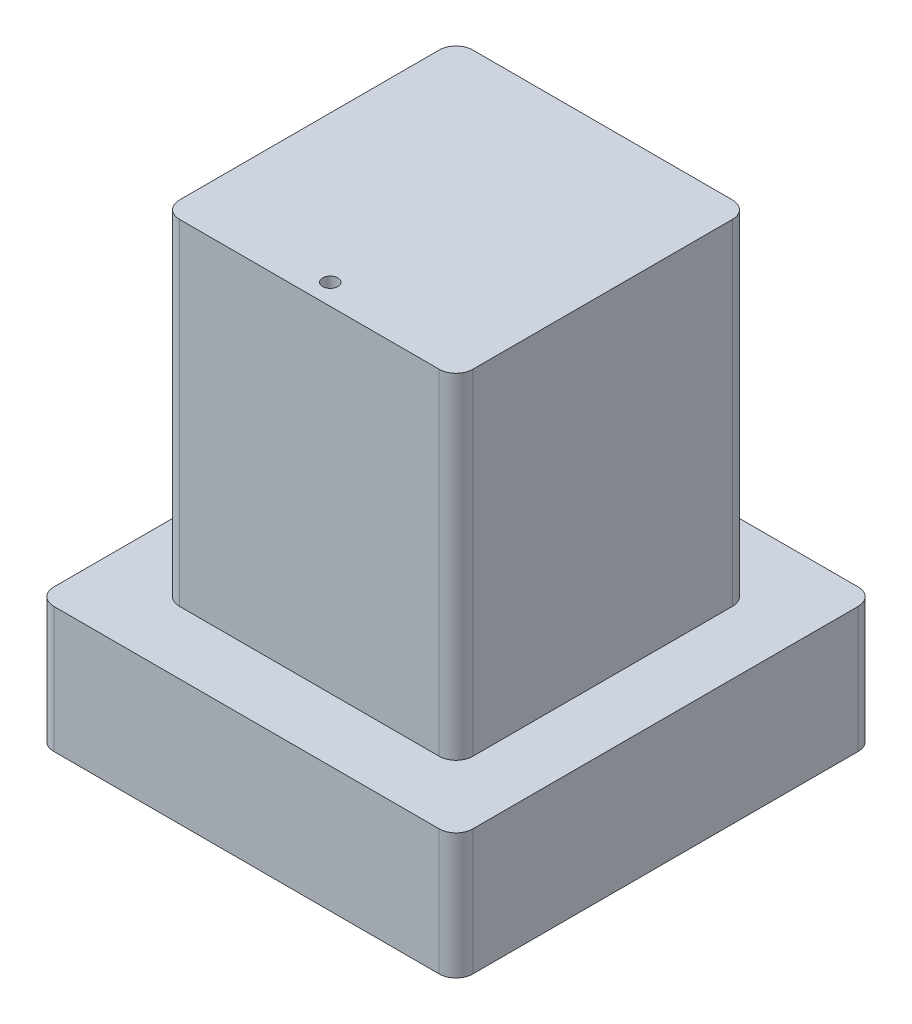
SolidWorks part; units mm, degrees
ref_plane "Front Plane" through (0, 0, 0) normal (0, 0, 1) x (1, 0, 0)
ref_plane "Top Plane" through (0, 0, 0) normal (0, 1, 0) x (1, 0, 0)
ref_plane "Right Plane" through (0, 0, 0) normal (1, 0, 0) x (0, 0, -1)
sketch "Sketch1" plane through (0, 0, 0) normal (0, 1, 0) x (1, 0, 0)
  line L1 (63.5, -63.5) -> (-63.5, -63.5)
  line L2 (63.5, -63.5) -> (63.5, 63.5)
  line L3 (63.5, 63.5) -> (-63.5, 63.5)
  line L4 (-63.5, -63.5) -> (-63.5, 63.5)
  line L5 (63.5, -63.5) -> (-63.5, 63.5) construction
  line L6 (63.5, 63.5) -> (-63.5, -63.5) construction
  point P0 (0, 0)
  dimension "D1" = 127
  dimension "D2" = 127
extrude "Boss-Extrude1" add sketch "Sketch1" along normal blind 38.1
sketch "Sketch2" plane through (0, 38.1, 0) normal (0, 1, 0) x (1, 0, 0)
  line L1 (44.45, 44.45) -> (-44.45, 44.45)
  line L2 (44.45, 44.45) -> (44.45, -44.45)
  line L3 (44.45, -44.45) -> (-44.45, -44.45)
  line L4 (-44.45, 44.45) -> (-44.45, -44.45)
  line L5 (44.45, 44.45) -> (-44.45, -44.45) construction
  line L6 (44.45, -44.45) -> (-44.45, 44.45) construction
  point P0 (0, 0)
  dimension "D1" = 88.9
  dimension "D2" = 88.9
extrude "Boss-Extrude2" add sketch "Sketch2" along normal blind 101.6 separate body
fillet "Fillet1" radius 5.08 4 edges at (63.5, 19.05, 63.5) (63.5, 19.05, -63.5) (-63.5, 19.05, -63.5) (-63.5, 19.05, 63.5)
fillet "Fillet2" radius 5.08 4 edges at (44.45, 88.9, 44.45) (-44.45, 88.9, 44.45) (-44.45, 88.9, -44.45) (44.45, 88.9, -44.45)
sketch "Sketch3" plane through (0, 139.7, 0) normal (0, 1, 0) x (1, 0, 0)
  line L0 (-39.37, -44.45) -> (39.37, -44.45) construction
  circle A0 centre (0, -38.1) radius 2.2987
  dimension "D1" = 4.5974
  dimension "D2" = 6.35
extrude "Cut-Extrude1" cut sketch "Sketch3" against normal blind 6.35 contours A0
